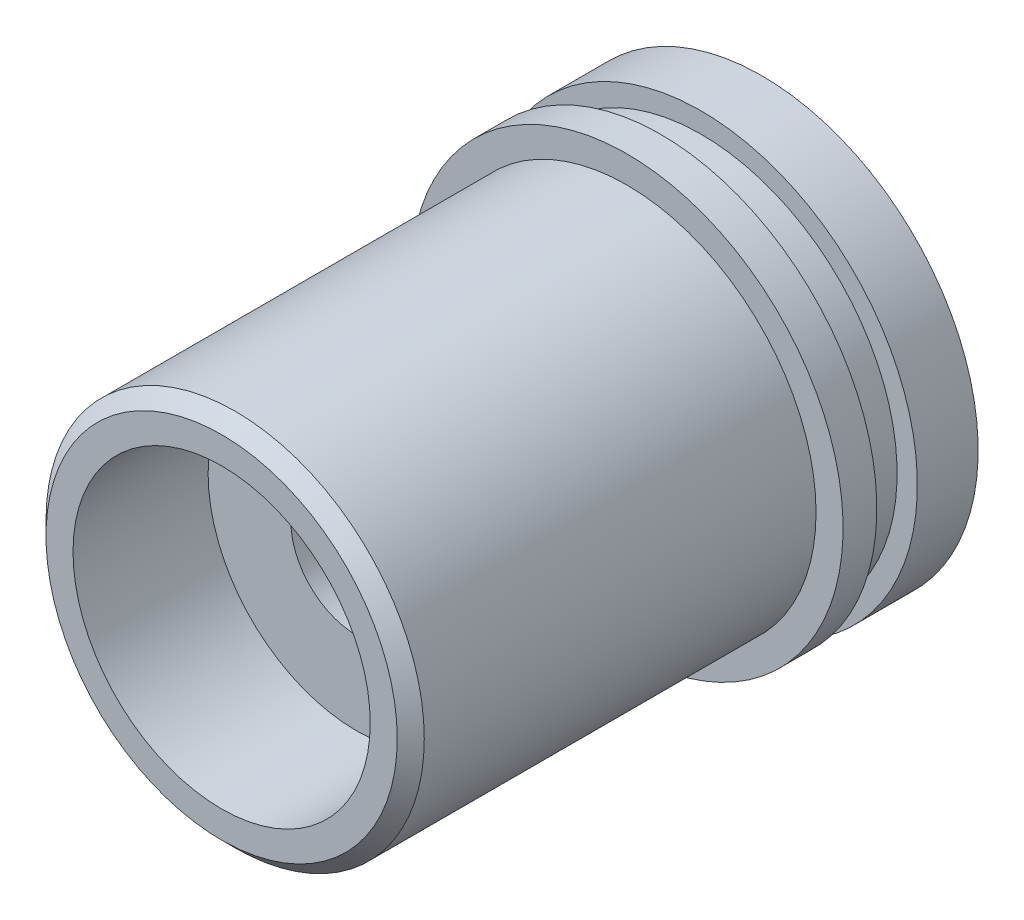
SolidWorks part; units mm, degrees
ref_plane "XY" through (0, 0, 0) normal (0, 0, 1) x (1, 0, 0)
ref_plane "XZ" through (0, 0, 0) normal (0, 1, 0) x (1, 0, 0)
ref_plane "YZ" through (0, 0, 0) normal (1, 0, 0) x (0, 0, -1)
sketch "Esquisse1" plane through (0, 0, 0) normal (0, 1, 0) x (1, 0, 0)
  line L0 (0, 11.0873) -> (0, -45.8275) construction
  line L1 (-7.5, 10) -> (-16, 10)
  line L2 (-16, 10) -> (-16, 5.5)
  line L3 (-16, 5.5) -> (-14.5, 5.5)
  line L4 (-14.5, 5.5) -> (-14.5, 2.5)
  line L5 (-14.5, 2.5) -> (-16, 2.5)
  line L6 (-16, 2.5) -> (-16, 0)
  line L7 (-16, 0) -> (-14, 0)
  line L8 (-14, 0) -> (-14, -30)
  line L9 (-14, -30) -> (-11, -30)
  line L10 (-11, -30) -> (-11, -20)
  line L11 (-11, -20) -> (-4.8753, -20)
  line L12 (-4.8753, -20) -> (-7.5, 10)
  dimension "D1" = 32
  dimension "D2" = 10
  dimension "D3" = 30
  dimension "D4" = 28
  dimension "D5" = 5
  dimension "D6" = 15
  dimension "D7" = 2.5
  dimension "D8" = 3
  dimension "D9" = 29
  dimension "D10" = 22
  dimension "D11" = 10
revolve "Bague d15" add sketch "Esquisse1" angle 360 about L0
chamfer "Chanf 1" distance 1 angle 45
